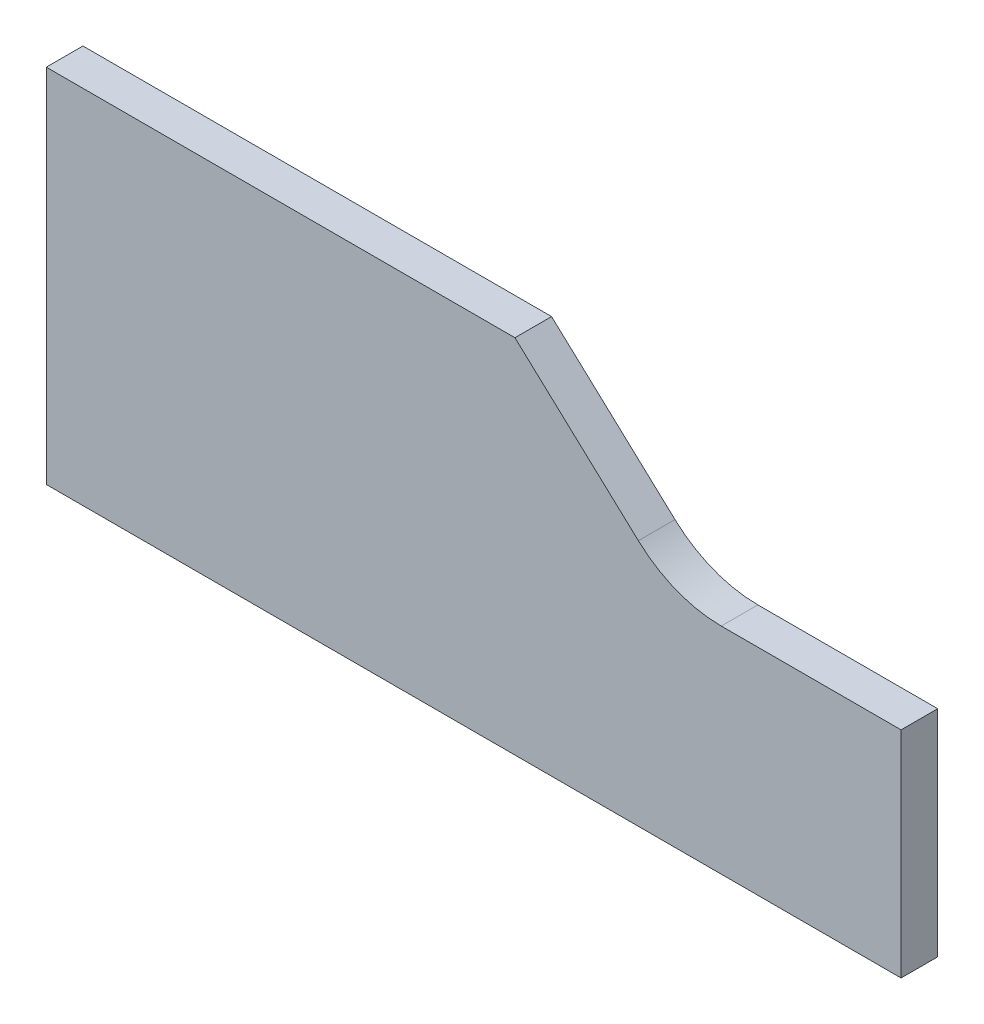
SolidWorks part; units mm, degrees
ref_plane "Front" through (0, 0, 0) normal (0, 0, 1) x (1, 0, 0)
ref_plane "Top" through (0, 0, 0) normal (0, 1, 0) x (1, 0, 0)
ref_plane "Right" through (0, 0, 0) normal (1, 0, 0) x (0, 0, -1)
sketch "Skizze1" plane through (0, 0, 0) normal (0, 0, 1) x (1, 0, 0)
  line L0 (0, 0) -> (0, 29.5989)
  line L1 (0, 29.5989) -> (38.3795, 29.5989)
  line L2 (38.3795, 29.5989) -> (51.3615, 17.5989)
  line L3 (51.3615, 17.5989) -> (70, 17.5989)
  line L4 (70, 17.5989) -> (70, 0)
  line L5 (70, 0) -> (0, 0)
  dimension "D1" = 12
  dimension "D2" = 70
extrude "Aufsatz-Linear austragen1" add sketch "Skizze1" along normal mid plane 3
fillet "Verrundung1" radius 10 1 edges at (51.3615, 17.5989, 0)
